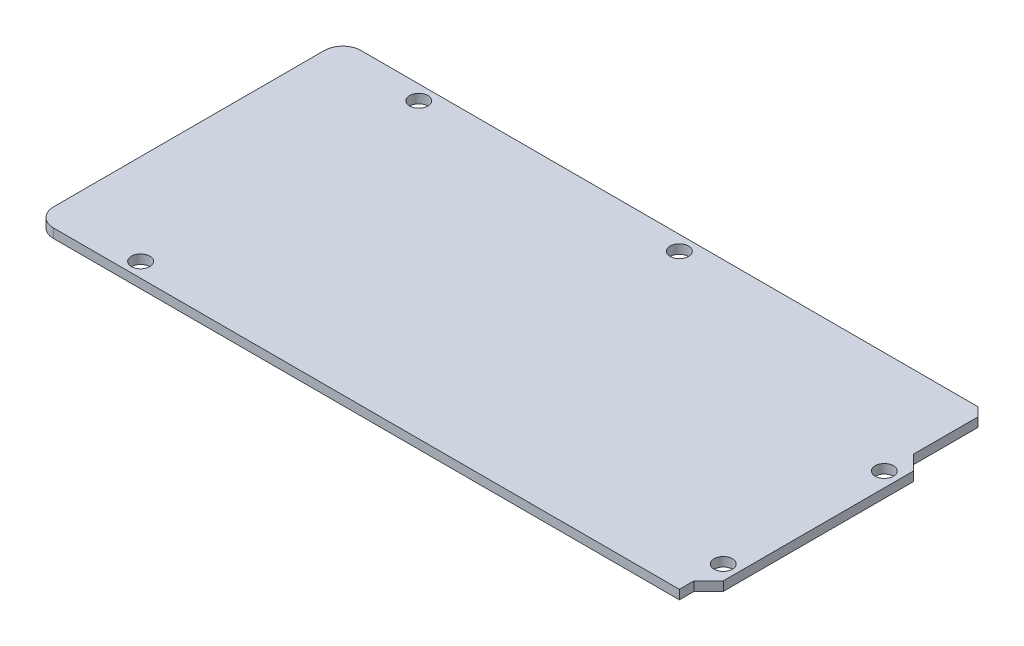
SolidWorks part; units mm, degrees
ref_plane "Front Plane" through (0, 0, 0) normal (0, 0, 1) x (1, 0, 0)
ref_plane "Top Plane" through (0, 0, 0) normal (0, 1, 0) x (1, 0, 0)
ref_plane "Right Plane" through (0, 0, 0) normal (1, 0, 0) x (0, 0, -1)
sketch "Sketch1" plane through (0, 0, 0) normal (0, 1, 0) x (1, 0, 0)
  line L0 (111.76, 2.54) -> (114.3, 5.08)
  line L1 (3.175, 0) -> (111.76, 0)
  line L2 (0, 3.175) -> (0, 50.165)
  line L3 (3.175, 53.34) -> (110.236, 53.34)
  line L4 (111.76, 0) -> (111.76, 2.54)
  line L5 (114.3, 5.08) -> (114.3, 38.1)
  line L6 (114.3, 38.1) -> (111.76, 40.64)
  line L7 (111.76, 51.816) -> (110.236, 53.34)
  line L10 (111.76, 40.64) -> (111.76, 51.816)
  arc A0 (3.175, 0) -> (0, 3.175) centre (3.175, 3.175) cw
  arc A1 (0, 50.165) -> (3.175, 53.34) centre (3.175, 50.165) cw
  point P14 (0, 0)
  point P17 (0, 53.34)
  dimension "D7" = 3.175
  dimension "D1" = 111.76
  dimension "D2" = 53.34
  dimension "D3" = 1.524
  dimension "D4" = 2.54
  dimension "D5" = 1.524
  dimension "D8" = 2.54
  dimension "D9" = 33.02
extrude "Boss-Extrude1" add sketch "Sketch1" along normal blind 1.5875
hole_wizard "1/8 (0.125) Diameter Hole1" positions "3DSketch1" profile "Sketch2" hole size "1/8" standard "Ansi Inch"
sketch3d "3DSketch1"
  line L0 (15.748, 1.5875, -50.8) -> (15.748, 1.5875, -2.54) construction
  line L1 (15.748, 1.5875, -50.8) -> (60.96, 1.5875, -50.8) construction
  line L3 (111.76, 1.5875, -35.56) -> (111.76, 1.5875, -7.62) construction
  line L5 (110.236, 1.5875, -53.34) -> (3.175, 1.5875, -53.34) construction
  line L6 (3.175, 1.5875, 0) -> (111.76, 1.5875, 0) construction
  line L7 (111.76, 1.5875, -40.64) -> (111.76, 1.5875, -51.816) construction
  line L8 (0, 1.5875, -50.165) -> (0, 1.5875, -3.175) construction
  point P0 (15.748, 1.5875, -50.8)
  point P2 (15.748, 1.5875, -2.54)
  point P4 (60.96, 1.5875, -50.8)
  point P6 (111.76, 1.5875, -35.56)
  point P8 (111.76, 1.5875, -7.62)
  dimension "D1" = 2.54
  dimension "D2" = 2.54
  dimension "D3" = 15.748
  dimension "D4" = 60.96
  dimension "D5" = 27.94
  dimension "D6" = 7.62
sketch "Sketch2" plane through (15.748, 1.5875, -50.8) normal (1, 0, 0) x (0, 0, 1)
  line L0 (0, 0) -> (0, 1.5875)
  line L1 (0, 1.5875) -> (1.5875, 1.5875)
  line L2 (1.5875, 1.5875) -> (1.5875, 0)
  line L5 (1.5875, 0) -> (0, 0)
  line L11 (0, -6.35) -> (0, 107.95) construction
  dimension "Thru Hole Dia." = 3.175
  dimension "Thru Hole Depth" = 1.5875
